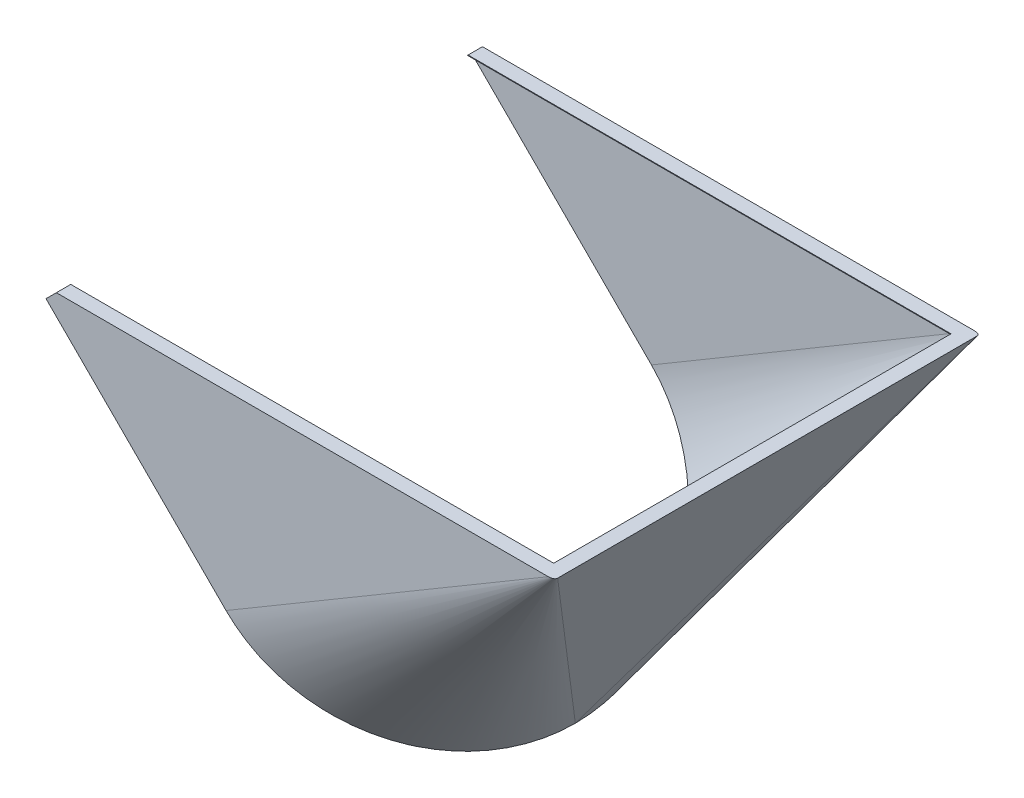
SolidWorks part; units mm, degrees
ref_plane "Ebene vorne" through (0, 0, 0) normal (0, 0, 1) x (1, 0, 0)
ref_plane "Ebene oben" through (0, 0, 0) normal (0, 1, 0) x (1, 0, 0)
ref_plane "Ebene rechts" through (0, 0, 0) normal (1, 0, 0) x (0, 0, -1)
sketch "Skizze1" plane through (0, 0, 0) normal (0, 0, 1) x (1, 0, 0)
  line L0 (0, 0) -> (726, 0)
  line L1 (726, 0) -> (446.7157, -475)
  line L2 (446.7157, -475) -> (-14.1421, -14.1421)
  line L3 (0, 0) -> (-14.1421, -14.1421)
  dimension "D1" = 726
  dimension "D2" = 45
  dimension "D3" = 475
  dimension "D4" = 20
extrude "Linear austragen1" add sketch "Skizze1" along normal mid plane 620
fillet "Variabler Verrundungsradius1" radius 5 2 edges at (586.3579, -237.5, -310) (586.3579, -237.5, 310)
sketch "Skizze2" plane through (0, 0, 0) normal (0, 1, 0) x (-1, 0, 0)
  line L0 (14.1421, 310) -> (14.1421, -310) construction
  line L1 (14.1421, -290) -> (-706, -290)
  line L2 (14.1421, -290) -> (14.1421, 290)
  line L3 (14.1421, 290) -> (-706, 290)
  line L4 (-706, -290) -> (-706, 290)
  line L6 (-706, 0) -> (-726, 0) construction
  line L7 (-726, 305) -> (-726, -305) construction
  line L8 (-717.4013, 310) -> (0, 310) construction
  dimension "D1" = 20
  dimension "D2" = 20
extrude "Schnitt-Linear austragen1" cut sketch "Skizze2" against normal blind 5
shell "Wandung3" thickness 1
